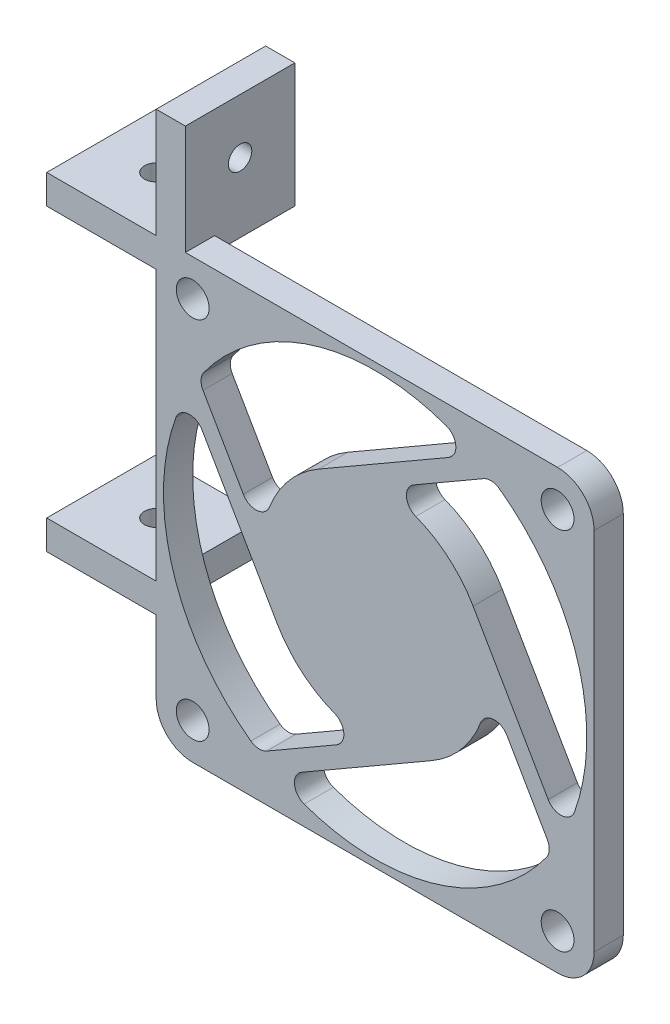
SolidWorks part; units mm, degrees
ref_plane "Front Plane" through (0, 0, 0) normal (0, 0, 1) x (1, 0, 0)
ref_plane "Top Plane" through (0, 0, 0) normal (0, 1, 0) x (1, 0, 0)
ref_plane "Right Plane" through (0, 0, 0) normal (1, 0, 0) x (0, 0, -1)
sketch "Sketch1" plane through (0, 0, 0) normal (0, 0, 1) x (1, 0, 0)
  line L0 (30, 60) -> (30, 0) construction
  line L1 (0, 0) -> (60, 0)
  line L2 (0, 0) -> (0, 60)
  line L3 (0, 60) -> (60, 60)
  line L4 (60, 0) -> (60, 60)
  line L5 (0, 30) -> (60, 30) construction
  line L6 (22.25, 43.4234) -> (40.0562, 53.7038)
  line L7 (44.8542, 53.5872) -> (35.2872, 48.0637)
  line L8 (22.25, 43.4234) -> (30, 30) construction
  line L9 (43.4234, 37.75) -> (53.7038, 19.9438)
  line L10 (53.5872, 15.1458) -> (48.0637, 24.7128)
  line L11 (37.75, 16.5766) -> (19.9438, 6.2962)
  line L12 (15.1458, 6.4128) -> (24.7128, 11.9363)
  line L13 (16.5766, 22.25) -> (6.2962, 40.0562)
  line L14 (6.4128, 44.8542) -> (11.9363, 35.2872)
  arc A0 (39.7271, 57.32) -> (6.526, 47.0285) centre (30, 30) ccw
  circle A1 centre (5, 5) radius 2.25
  circle A2 centre (55, 5) radius 2.25
  circle A3 centre (55, 55) radius 2.25
  circle A4 centre (5, 55) radius 2.25
  arc A5 (22.25, 43.4234) -> (15.5349, 35.5686) centre (30, 30) ccw
  arc A6 (44.8542, 53.5872) -> (47.0285, 53.474) centre (45.8542, 51.8551) cw
  arc A7 (40.0562, 53.7038) -> (39.7271, 57.32) centre (39.0562, 55.4359) ccw
  arc A8 (35.2872, 48.0637) -> (35.5686, 44.4651) centre (36.2872, 46.3316) ccw
  arc A9 (48.0637, 24.7128) -> (44.4651, 24.4314) centre (46.3316, 23.7128) ccw
  arc A10 (53.5872, 15.1458) -> (53.474, 12.9715) centre (51.8551, 14.1458) cw
  arc A11 (53.7038, 19.9438) -> (57.32, 20.2729) centre (55.4359, 20.9438) ccw
  arc A12 (24.7128, 11.9363) -> (24.4314, 15.5349) centre (23.7128, 13.6684) ccw
  arc A13 (15.1458, 6.4128) -> (12.9715, 6.526) centre (14.1458, 8.1449) cw
  arc A14 (19.9438, 6.2962) -> (20.2729, 2.68) centre (20.9438, 4.5641) ccw
  arc A15 (11.9363, 35.2872) -> (15.5349, 35.5686) centre (13.6684, 36.2872) ccw
  arc A16 (6.4128, 44.8542) -> (6.526, 47.0285) centre (8.1449, 45.8542) cw
  arc A17 (6.2962, 40.0562) -> (2.68, 39.7271) centre (4.5641, 39.0562) ccw
  arc A18 (2.68, 39.7271) -> (12.9715, 6.526) centre (30, 30) ccw
  arc A19 (16.5766, 22.25) -> (24.4314, 15.5349) centre (30, 30) ccw
  arc A20 (43.4234, 37.75) -> (35.5686, 44.4651) centre (30, 30) ccw
  arc A21 (37.75, 16.5766) -> (44.4651, 24.4314) centre (30, 30) ccw
  arc A22 (20.2729, 2.68) -> (53.474, 12.9715) centre (30, 30) ccw
  arc A23 (57.32, 20.2729) -> (47.0285, 53.474) centre (30, 30) ccw
  point P61 (30, 30)
  dimension "D3" = 58
  dimension "D4" = 4.5
  dimension "D7" = 31
  dimension "D9" = 2
  dimension "D1" = 60
  dimension "D2" = 60
  dimension "D5" = 50
  dimension "D6" = 50
  dimension "D8" = 2.5
  dimension "D10" = 60
  dimension "D11" = 4
extrude "Boss-Extrude1" add sketch "Sketch1" against normal blind 4
fillet "Fillet1" radius 5 3 edges at (60, 0, -2) (60, 60, -2) (0, 0, -2)
sketch "Sketch2" plane through (0, 0, 0) normal (0, 0, 1) x (1, 0, 0)
  line L0 (0, 60) -> (0, 5) construction
  line L1 (0, 19) -> (-15, 19)
  line L2 (0, 19) -> (0, 15)
  line L3 (0, 15) -> (-15, 15)
  line L4 (-15, 19) -> (-15, 15)
  line L5 (0, 60) -> (0, 75)
  line L6 (4, 58) -> (2, 56)
  line L8 (0, 75) -> (4, 75)
  line L9 (4, 58) -> (4, 75)
  line L10 (2, 56) -> (-15, 56)
  line L12 (0, 60) -> (-15, 60)
  line L13 (-15, 56) -> (-15, 60)
  point P12 (4, 56)
  point P19 (0, 0)
  point P21 (0, 0)
  point P23 (0, 0)
  dimension "D1" = 15
  dimension "D2" = 15
  dimension "D3" = 4
  dimension "D4" = 15
  dimension "D5" = 4
  dimension "D6" = 4
  dimension "D7" = 75
extrude "Boss-Extrude3" add sketch "Sketch2" against normal blind 15
sketch "Sketch3" plane through (0, 0, 0) normal (-1, 0, 0) x (0, 0, 1)
  line L0 (-7.5, 75) -> (-7.5, 60) construction
  line L1 (-15, 75) -> (0, 75) construction
  line L2 (-15, 60) -> (0, 60) construction
  circle A0 centre (-7.5, 67.5) radius 1.6
  dimension "D1" = 3.2
extrude "Cut-Extrude1" cut sketch "Sketch3" against normal through all
sketch "Sketch4" plane through (0, 60, 0) normal (0, 1, 0) x (1, 0, 0)
  line L0 (-15, 7.5) -> (0, 7.5) construction
  line L1 (-15, 15) -> (-15, 0) construction
  line L2 (0, 15) -> (0, 0) construction
  circle A0 centre (-7.5, 7.5) radius 1.6
  dimension "D1" = 3.2
extrude "Cut-Extrude2" cut sketch "Sketch4" against normal through all
